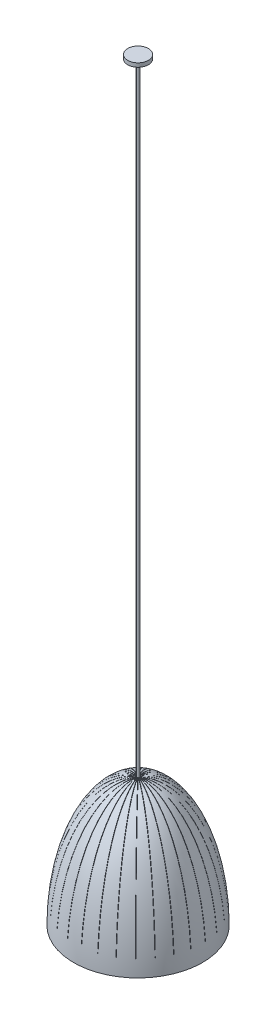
SolidWorks part; units mm, degrees
ref_plane "Alzado" through (0, 0, 0) normal (0, 0, 1) x (1, 0, 0)
ref_plane "Planta" through (0, 0, 0) normal (0, 1, 0) x (1, 0, 0)
ref_plane "Vista lateral" through (0, 0, 0) normal (1, 0, 0) x (0, 0, -1)
sketch "Croquis1" plane through (0, 0, 0) normal (0, 0, 1) x (1, 0, 0)
  line L0 (0, 500) -> (0, 2900) construction
  line L1 (-4.92, 497.9016) -> (0, 497.9016)
  line L2 (0, 500) -> (0, 2900) construction
  line L3 (0, 2900) -> (0, 2925) construction
  line L4 (-248, 0) -> (-250, 0)
  line L5 (0, 497.9016) -> (0, 500)
  line L6 (-5, 500) -> (-5, 2900)
  line L7 (-5, 500) -> (-5, 499.9)
  line L8 (-5, 2900) -> (-10, 2900)
  line L9 (-10, 2900) -> (-10, 2910)
  line L10 (-10, 2910) -> (-40, 2910)
  line L11 (-40, 2910) -> (-40, 2925)
  line L12 (-40, 2925) -> (0, 2925)
  line L13 (0, 2925) -> (0, 500)
  ellipse E0 centre (0, 0) end of major axis (0, 500) minor radius 250 (-5, 499.9) -> (-250, 0) ccw
  spline S0 degree 1 poles (-4.92, 497.9016) (-248, 0) knots 0 0 1 1 construction
  spline S1 degree 3 poles (-4.92, 497.9016) (-8.9026, 497.7423) (-16.8322, 497.0397) (-32.68, 494.0945) (-52.332, 487.5353) (-75.4784, 475.1085) (-105.4596, 452.5964) (-140.7317, 413.6507) (-177.8495, 351.3256) (-208.3091, 275.7657) (-227.1633, 204.1435) (-237.9017, 143.2767) (-243.7106, 96.2722) (-247.2181, 48.3749) (-248, 16.1012) (-248, 0) knots 0.020001 0.020001 0.020001 0.020001 0.068464 0.116926 0.213851 0.310775 0.4077 0.601549 0.795399 0.989248 1.183098 1.280022 1.376947 1.473872 1.570796 1.570796 1.570796 1.570796
  dimension "D5" = 2
  dimension "D1" = 2900
  dimension "D2" = 500
  dimension "D3" = 25
  dimension "D4" = 2925
revolve "Revolución1" add sketch "Croquis1" angle 360 about L0
ref_plane "Plano1" through (0, 500, 0) normal (0, -1, 0) x (-1, 0, 0)
sketch "Croquis17" plane through (0, 500, 0) normal (0, -1, 0) x (-1, 0, 0)
  line L0 (1.5459, 4.697) -> (53.8008, 242.0934)
  line L1 (0.5, 4.9195) -> (0.5, 247.999)
  line L2 (-0.4999, 4.9195) -> (-0.4999, 247.9995)
  line L3 (0.5693, 4.912) -> (52.8243, 242.3089)
  line L4 (2.5194, 4.2549) -> (104.5859, 224.8678)
  line L5 (1.6119, 4.6748) -> (103.6785, 225.2882)
  line L6 (3.3752, 3.6138) -> (150.4806, 197.1277)
  line L7 (2.5792, 4.219) -> (149.6849, 197.7332)
  line L8 (4.0732, 2.8038) -> (189.3391, 160.1701)
  line L9 (3.4258, 3.5659) -> (188.6921, 160.9325)
  line L10 (4.5807, 1.8626) -> (219.3443, 115.7231)
  line L11 (4.1123, 2.7461) -> (218.8764, 116.6068)
  line L12 (4.874, 0.8343) -> (239.0932, 65.865)
  line L13 (4.6065, 1.7978) -> (238.8262, 66.8286)
  line L14 (4.9394, -0.2329) -> (247.6624, 12.9271)
  line L15 (4.8853, 0.7656) -> (247.6087, 13.9256)
  line L16 (4.7738, -1.2893) -> (244.6511, -40.6152)
  line L17 (4.9356, -0.3025) -> (244.8134, -39.6285)
  line L18 (4.3851, -2.2854) -> (230.2002, -92.2584)
  line L19 (4.7552, -1.3565) -> (230.5708, -91.3296)
  line L20 (3.7913, -3.1746) -> (204.9854, -139.5877)
  line L21 (4.3524, -2.347) -> (205.547, -138.7603)
  line L22 (3.0202, -3.9154) -> (170.1858, -180.39)
  line L23 (3.7461, -3.2278) -> (170.9121, -179.7027)
  line L24 (2.1079, -4.4731) -> (127.4284, -212.7575)
  line L25 (2.9647, -3.9576) -> (128.2855, -212.2424)
  line L26 (1.097, -4.8217) -> (78.7126, -235.1767)
  line L27 (2.0446, -4.5024) -> (79.6604, -234.8579)
  line L28 (0.0348, -4.9448) -> (26.3163, -246.5993)
  line L29 (1.0289, -4.8367) -> (27.3105, -246.4917)
  line L30 (-1.029, -4.8366) -> (-27.3105, -246.4912)
  line L31 (-0.0349, -4.9448) -> (-26.3164, -246.5998)
  line L32 (-2.0446, -4.5024) -> (-79.6603, -234.8574)
  line L33 (-1.097, -4.8217) -> (-78.7128, -235.1771)
  line L34 (-2.9647, -3.9576) -> (-128.2853, -212.2419)
  line L35 (-2.1079, -4.4731) -> (-127.4287, -212.7579)
  line L36 (-3.7462, -3.2277) -> (-170.9118, -179.7023)
  line L37 (-3.0202, -3.9154) -> (-170.1862, -180.3903)
  line L38 (-4.3524, -2.3469) -> (-205.5466, -138.76)
  line L39 (-3.7913, -3.1746) -> (-204.9859, -139.5879)
  line L40 (-4.7552, -1.3564) -> (-230.5704, -91.3294)
  line L41 (-4.3851, -2.2854) -> (-230.2007, -92.2585)
  line L42 (-4.9356, -0.3025) -> (-244.8129, -39.6284)
  line L43 (-4.7739, -1.2893) -> (-244.6516, -40.6152)
  line L44 (-4.8853, 0.7656) -> (-247.6082, 13.9257)
  line L45 (-4.9394, -0.2329) -> (-247.6629, 12.9272)
  line L46 (-4.6065, 1.7979) -> (-238.8257, 66.8285)
  line L47 (-4.874, 0.8344) -> (-239.0937, 65.8652)
  line L48 (-4.1123, 2.7461) -> (-218.8759, 116.6066)
  line L49 (-4.5807, 1.8626) -> (-219.3447, 115.7233)
  line L50 (-3.4258, 3.5659) -> (-188.6917, 160.9322)
  line L51 (-4.0732, 2.8038) -> (-189.3395, 160.1704)
  line L52 (-2.5791, 4.219) -> (-149.6846, 197.7329)
  line L53 (-3.3752, 3.6139) -> (-150.4809, 197.1281)
  line L54 (-1.6119, 4.6748) -> (-103.6783, 225.2877)
  line L55 (-2.5194, 4.2549) -> (-104.586, 224.8683)
  line L56 (-0.5692, 4.912) -> (-52.8241, 242.3084)
  line L57 (-1.5458, 4.6971) -> (-53.8008, 242.0939)
  arc A1 (0.5, 247.999) -> (-0.4999, 247.999) centre (0, 0) ccw
  arc A3 (0.5, 4.9195) -> (-0.4999, 4.9195) centre (0, 0) ccw
  arc A4 (53.8008, 242.0934) -> (52.8242, 242.3084) centre (0, 0) ccw
  arc A5 (1.5459, 4.697) -> (0.5693, 4.912) centre (0, 0) ccw
  arc A6 (104.5859, 224.8678) -> (103.6783, 225.2877) centre (0, 0) ccw
  arc A7 (2.5194, 4.2549) -> (1.6119, 4.6748) centre (0, 0) ccw
  arc A8 (150.4806, 197.1277) -> (149.6846, 197.7328) centre (0, 0) ccw
  arc A9 (3.3752, 3.6138) -> (2.5792, 4.219) centre (0, 0) ccw
  arc A10 (189.3391, 160.1701) -> (188.6918, 160.9322) centre (0, 0) ccw
  arc A11 (4.0732, 2.8038) -> (3.4258, 3.5659) centre (0, 0) ccw
  arc A12 (219.3443, 115.7231) -> (218.8759, 116.6065) centre (0, 0) ccw
  arc A13 (4.5807, 1.8626) -> (4.1123, 2.7461) centre (0, 0) ccw
  arc A14 (239.0932, 65.865) -> (238.8257, 66.8285) centre (0, 0) ccw
  arc A15 (4.874, 0.8343) -> (4.6065, 1.7978) centre (0, 0) ccw
  arc A16 (247.6624, 12.9271) -> (247.6082, 13.9256) centre (0, 0) ccw
  arc A17 (4.9394, -0.2329) -> (4.8853, 0.7656) centre (0, 0) ccw
  arc A18 (244.6511, -40.6152) -> (244.8129, -39.6284) centre (0, 0) ccw
  arc A19 (4.7738, -1.2893) -> (4.9356, -0.3025) centre (0, 0) ccw
  arc A20 (230.2002, -92.2584) -> (230.5703, -91.3295) centre (0, 0) ccw
  arc A21 (4.3851, -2.2854) -> (4.7552, -1.3565) centre (0, 0) ccw
  arc A22 (204.9854, -139.5877) -> (205.5466, -138.76) centre (0, 0) ccw
  arc A23 (3.7913, -3.1746) -> (4.3524, -2.347) centre (0, 0) ccw
  arc A24 (170.1858, -180.39) -> (170.9117, -179.7023) centre (0, 0) ccw
  arc A25 (3.0202, -3.9154) -> (3.7461, -3.2278) centre (0, 0) ccw
  arc A26 (127.4284, -212.7575) -> (128.2852, -212.242) centre (0, 0) ccw
  arc A27 (2.1079, -4.4731) -> (2.9647, -3.9576) centre (0, 0) ccw
  arc A28 (78.7126, -235.1767) -> (79.6602, -234.8574) centre (0, 0) ccw
  arc A29 (1.097, -4.8217) -> (2.0446, -4.5024) centre (0, 0) ccw
  arc A30 (26.3163, -246.5993) -> (27.3104, -246.4912) centre (0, 0) ccw
  arc A31 (0.0348, -4.9448) -> (1.0289, -4.8367) centre (0, 0) ccw
  arc A32 (-27.3105, -246.4912) -> (-26.3164, -246.5993) centre (0, 0) ccw
  arc A33 (-1.029, -4.8366) -> (-0.0349, -4.9448) centre (0, 0) ccw
  arc A34 (-79.6603, -234.8574) -> (-78.7127, -235.1767) centre (0, 0) ccw
  arc A35 (-2.0446, -4.5024) -> (-1.097, -4.8217) centre (0, 0) ccw
  arc A36 (-128.2853, -212.2419) -> (-127.4285, -212.7575) centre (0, 0) ccw
  arc A37 (-2.9647, -3.9576) -> (-2.1079, -4.4731) centre (0, 0) ccw
  arc A38 (-170.9118, -179.7023) -> (-170.1858, -180.39) centre (0, 0) ccw
  arc A39 (-3.7462, -3.2277) -> (-3.0202, -3.9154) centre (0, 0) ccw
  arc A40 (-205.5466, -138.76) -> (-204.9855, -139.5876) centre (0, 0) ccw
  arc A41 (-4.3524, -2.3469) -> (-3.7913, -3.1746) centre (0, 0) ccw
  arc A42 (-230.5704, -91.3294) -> (-230.2002, -92.2583) centre (0, 0) ccw
  arc A43 (-4.7552, -1.3564) -> (-4.3851, -2.2854) centre (0, 0) ccw
  arc A44 (-244.8129, -39.6284) -> (-244.6511, -40.6151) centre (0, 0) ccw
  arc A45 (-4.9356, -0.3025) -> (-4.7739, -1.2893) centre (0, 0) ccw
  arc A46 (-247.6082, 13.9257) -> (-247.6624, 12.9272) centre (0, 0) ccw
  arc A47 (-4.8853, 0.7656) -> (-4.9394, -0.2329) centre (0, 0) ccw
  arc A48 (-238.8257, 66.8285) -> (-239.0932, 65.865) centre (0, 0) ccw
  arc A49 (-4.6065, 1.7979) -> (-4.874, 0.8344) centre (0, 0) ccw
  arc A50 (-218.8759, 116.6066) -> (-219.3443, 115.7231) centre (0, 0) ccw
  arc A51 (-4.1123, 2.7461) -> (-4.5807, 1.8626) centre (0, 0) ccw
  arc A52 (-188.6917, 160.9322) -> (-189.3391, 160.1701) centre (0, 0) ccw
  arc A53 (-3.4258, 3.5659) -> (-4.0732, 2.8038) centre (0, 0) ccw
  arc A54 (-149.6846, 197.7329) -> (-150.4806, 197.1277) centre (0, 0) ccw
  arc A55 (-2.5791, 4.219) -> (-3.3752, 3.6139) centre (0, 0) ccw
  arc A56 (-103.6783, 225.2877) -> (-104.5858, 224.8679) centre (0, 0) ccw
  arc A57 (-1.6119, 4.6748) -> (-2.5194, 4.2549) centre (0, 0) ccw
  arc A58 (-52.8241, 242.3084) -> (-53.8007, 242.0934) centre (0, 0) ccw
  arc A59 (-0.5692, 4.912) -> (-1.5458, 4.6971) centre (0, 0) ccw
  point P149 (0, 0)
  point P150 (0, 0)
  dimension "D1" = 29
extrude "Cortar-Extruir1" cut sketch "Croquis17" along normal through all contours A53 L50 A52 L51 | A55 L52 A54 L53 | A57 L54 A56 L55 | A59 L56 A58 L57 | A3 L1 A1 L2 | A5 L0 A4 L3 | A7 L4 A6 L5 | A9 L6 A8 L7 | A11 L8 A10 L9 | A13 L10 A12 L11 | A15 L12 A14 L13 | A17 L14 A16 L15 | A19 L16 A18 L17 | A21 L18 A20 L19 | A23 L20 A22 L21 | A25 L22 A24 L23 | A27 L24 A26 L25 | A29 L26 A28 L27 | A31 L28 A30 L29 | A33 L30 A32 L31 | A35 L32 A34 L33 | A37 L34 A36 L35 | A39 L36 A38 L37 | A41 L38 A40 L39 | A43 L40 A42 L41 | A45 L42 A44 L43 | A47 L44 A46 L45 | A49 L46 A48 L47 | A51 L48 A50 L49
